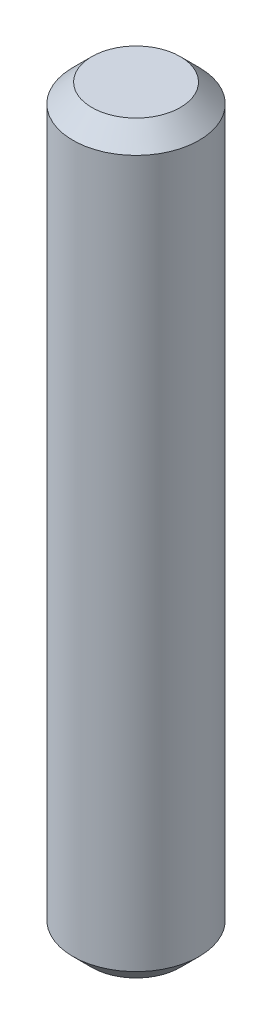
SolidWorks part; units mm, degrees
ref_plane "Plan1" through (0, 0, 0) normal (0, 0, 1) x (1, 0, 0)
ref_plane "Plan2" through (0, 0, 0) normal (0, 1, 0) x (1, 0, 0)
ref_plane "Plan3" through (0, 0, 0) normal (1, 0, 0) x (0, 0, -1)
sketch "Esquisse1" plane through (0, 0, 0) normal (0, 1, 0) x (1, 0, 0)
  circle A0 centre (0, 0) radius 1
  dimension "D1" = 2
extrude "Base-Extrusion" add sketch "Esquisse1" along normal blind 11.8
chamfer "Chanfrein1" distance 0.3 angle 45
